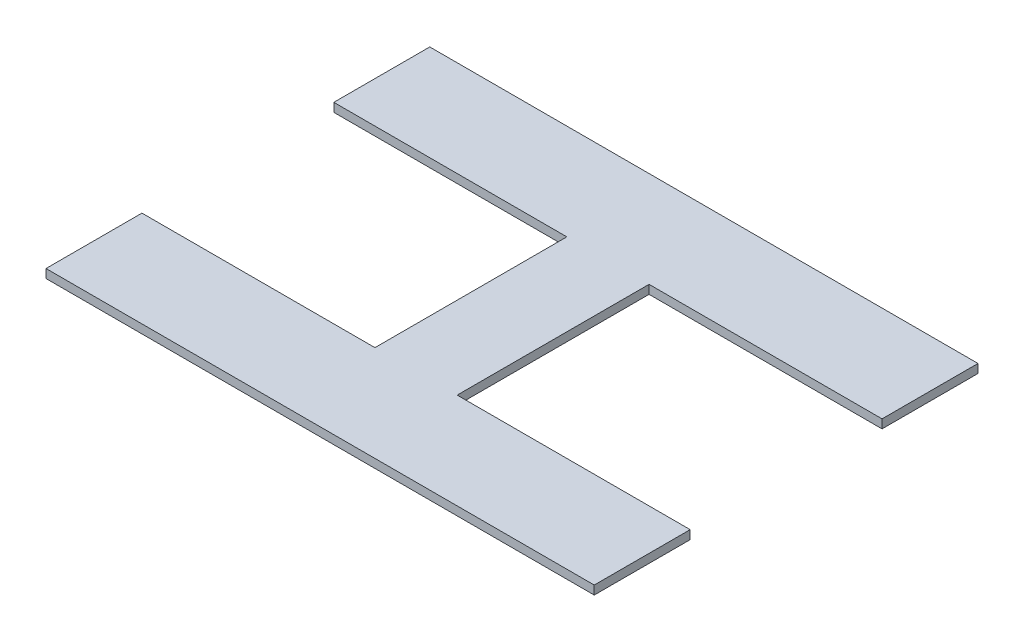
SolidWorks part; units mm, degrees
ref_plane "Front Plane" through (0, 0, 0) normal (0, 0, 1) x (1, 0, 0)
ref_plane "Top Plane" through (0, 0, 0) normal (0, 1, 0) x (1, 0, 0)
ref_plane "Right Plane" through (0, 0, 0) normal (1, 0, 0) x (0, 0, -1)
sketch "Sketch1" plane through (0, 0, 0) normal (0, 1, 0) x (1, 0, 0)
  line L1 (0, 0) -> (200, 0)
  line L2 (0, 0) -> (0, 140)
  line L3 (0, 140) -> (200, 140)
  line L4 (200, 0) -> (200, 140)
  dimension "D1" = 200
  dimension "D2" = 140
extrude "Boss-Extrude1" add sketch "Sketch1" along normal blind 3.175
sketch "Sketch2" plane through (0, 3.175, 0) normal (0, 1, 0) x (1, 0, 0)
  line L0 (0, 140) -> (0, 0) construction
  line L1 (0, 35) -> (85, 35)
  line L2 (0, 35) -> (0, 105)
  line L3 (0, 105) -> (85, 105)
  line L4 (85, 35) -> (85, 105)
  line L5 (100, 0) -> (100, 140) construction
  line L6 (0, 0) -> (200, 0) construction
  line L7 (200, 140) -> (0, 140) construction
  line L8 (115, 35) -> (115, 105)
  line L9 (200, 105) -> (115, 105)
  line L10 (200, 35) -> (200, 105)
  line L11 (200, 35) -> (115, 35)
  line L12 (200, 70) -> (0, 70) construction
  dimension "D1" = 70
  dimension "D3" = 85
extrude "Cut-Extrude1" cut sketch "Sketch2" against normal through all
